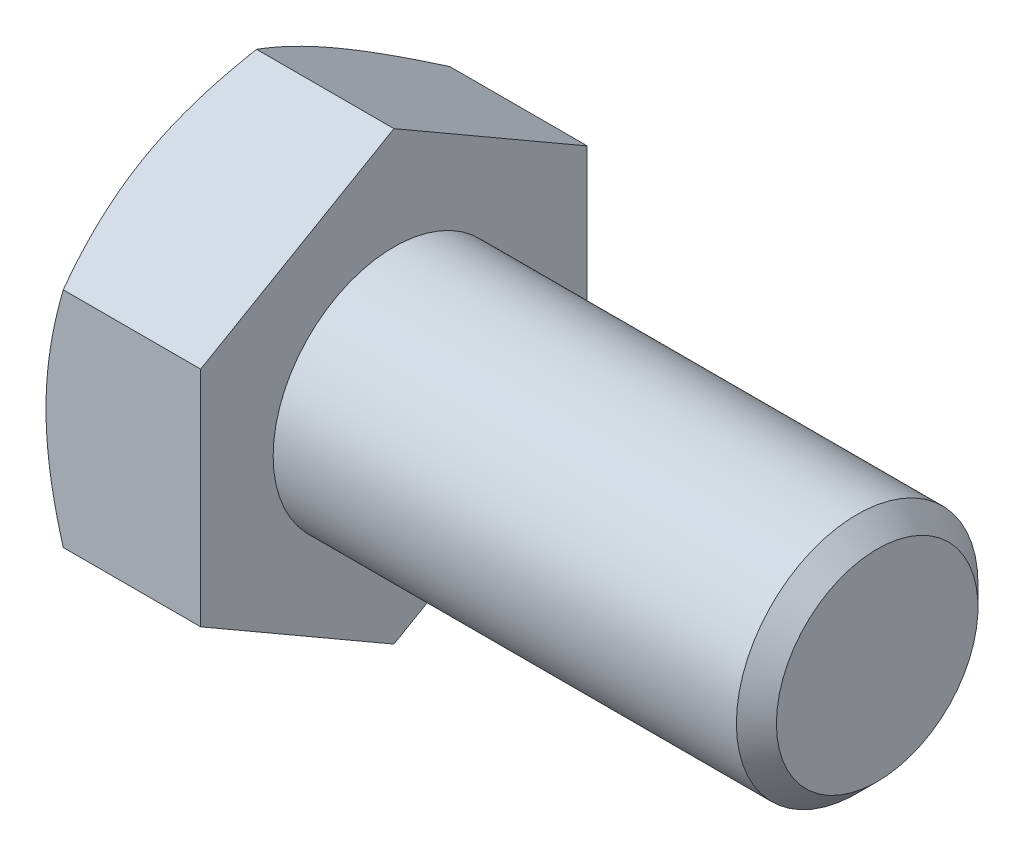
SolidWorks part; units mm, degrees
extrude "BaseHead" add sketch "Sketch1" along normal blind 6.4
sketch "Sketch1" plane through (0, 0, 0) normal (1, 0, 0) x (0, 0, -1)
  line L0 (8, 4.6188) -> (8, -4.6188)
  line L1 (-8, 4.6188) -> (-8, -4.6188)
  line L2 (8, -4.6188) -> (0, -9.2376)
  line L3 (0, -9.2376) -> (-8, -4.6188)
  line L4 (8, 4.6188) -> (0, 9.2376)
  line L5 (0, 9.2376) -> (-8, 4.6188)
ref_plane "Plane1" through (0, 0, 0) normal (0, 0, 1) x (1, 0, 0)
ref_plane "Plane2" through (0, 0, 0) normal (0, 1, 0) x (1, 0, 0)
ref_plane "Plane3" through (0, 0, 0) normal (1, 0, 0) x (0, 0, -1)
sketch "BodySke" plane through (0, 0, 0) normal (0, 0, 1) x (1, 0, 0)
  line L1 (0, 0) -> (26.4, 0)
  line L2 (0, 0) -> (0, 5)
  line L4 (26.4, 0) -> (26.4, 4.172)
  line L5 (6.4, 9.2376) -> (6.4, 4.6188) construction
  line L6 (26.4, 4.172) -> (25.572, 5)
  line L7 (0, 0) -> (110.49, 0) construction
  line L8 (26.4, -4.172) -> (25.572, -5) construction
  line L9 (0, 4.6188) -> (0, -4.6188) construction
  line L10 (7.9, 15.24) -> (7.9, -1.27) construction
  line L11 (0.4, 15.24) -> (0.4, -1.27) construction
  line L12 (6.4, 4.6188) -> (6.4, -4.6188) construction
  line L15 (0, 5) -> (25.572, 5)
revolve "BaseBody" add sketch "BodySke" angle 360 about L7
fillet "HeadFillet" [suppressed] radius 0.4
sketch "Sketch3" plane through (0, 0, 0) normal (0, 0, 1) x (1, 0, 0)
  line L0 (0, 8) -> (3.6013, 14.2376)
  line L1 (0, 9.2376) -> (0, 4.6188) construction
  line L2 (3.6013, 14.2376) -> (3.6013, 19.2376)
  line L3 (3.6013, 19.2376) -> (-10, 19.2376)
  line L4 (-10, 19.2376) -> (-10, 8)
  line L5 (-10, 8) -> (0, 8)
  line L6 (0, 0) -> (99.06, 0) construction
  line L7 (6.4, 9.2376) -> (0, 9.2376) construction
revolve "HeadChamfer" cut sketch "Sketch3" angle 360 about L6
sketch "ThdSchSke" plane through (0, 0, 0) normal (0, 0, 1) x (1, 0, 0)
  line L0 (7.9, -4.172) -> (7.3202, -5)
  line L1 (7.9, -4.172) -> (8.4798, -5)
  line L2 (8.4798, -5) -> (8.4798, -6.25)
  line L3 (-3.175, 0) -> (5.1513, 0) construction
  line L5 (8.4798, -6.25) -> (7.3202, -6.25)
  line L6 (7.3202, -6.25) -> (7.3202, -5)
revolve "ThreadSchematic" [suppressed] cut sketch "ThdSchSke" angle 360 about L3
pattern_linear "ThdSchPat" [suppressed]
equation "\"D3@Sketch1\" = \"Width_flats@Sketch1\" / 2"
equation "\"D4@Sketch1\" = \"D3@Sketch1\""
equation "\"D5@Sketch1\" = \"D4@Sketch1\""
equation "\"Thread_minor@ThreadCosmetic\" = \"Minor_dia@BodySke\""
equation "\"D1@Sketch3\" = \"Width_flats@Sketch1\" / 2"
equation "\"Thread_length@ThreadCosmetic\" = ((sgn( (\"Length@BodySke\" - \"Advance@BodySke\" ) - \"Thread_nom@BodySke\" )-1)*( (\"Length@BodySke\" - \"Advance@BodySke\" ) - \"Thread_nom@BodySke\" ))/-2+ \"Thread_nom@BodySke\""
equation "\"Thread_minor@ThdSchSke\" = \"Minor_dia@BodySke\""
equation "\"Diameter@ThdSchSke\" = \"Diameter@BodySke\""
equation "\"Overcut@ThdSchSke\" = \"Diameter@BodySke\" * 1.25"
equation "\"Start@ThdSchSke\" = \"Head_ht@BaseHead\" + \"Length@BodySke\" - \"Thread_length@ThreadCosmetic\"  '---Non-countersunk---"
equation "\"Num_threads@ThdSchPat\" = int( \"Thread_length@ThreadCosmetic\" / \"Advance@BodySke\" + 0.999 )  + 1"
equation "\"Advance@ThdSchPat\" = \"Thread_length@ThreadCosmetic\" /  (\"Num_threads@ThdSchPat\" - 1) 'relax it"
equation "\"Num_threads@ThdSchPat\" = \"Num_threads@ThdSchPat\" - sgn( \"Num_threads@ThdSchPat\" - 1) '---chamfered tips only---"
